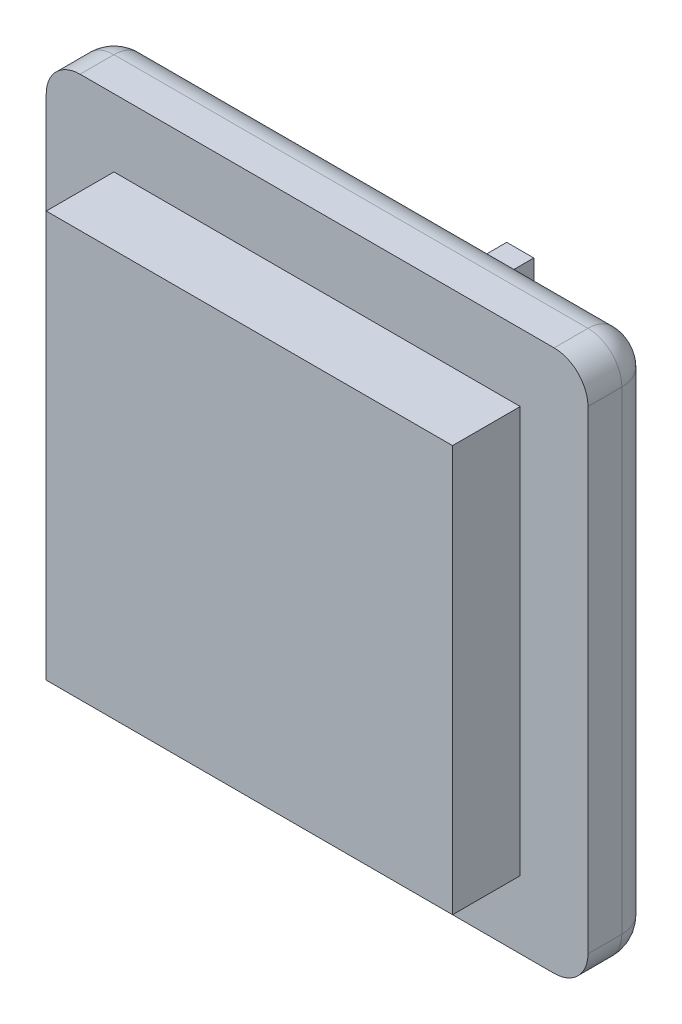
SolidWorks part; units mm, degrees
ref_plane "Plan de face" through (0, 0, 0) normal (0, 0, 1) x (1, 0, 0)
ref_plane "Plan de dessus" through (0, 0, 0) normal (0, 1, 0) x (1, 0, 0)
ref_plane "Plan de droite" through (0, 0, 0) normal (1, 0, 0) x (0, 0, -1)
sketch "Esquisse1" plane through (0, 0, 0) normal (0, 0, 1) x (1, 0, 0)
  line L1 (0, 0) -> (40, 0)
  line L2 (0, 0) -> (0, 40)
  line L3 (0, 40) -> (40, 40)
  line L4 (40, 0) -> (40, 40)
  dimension "D1" = 40
  dimension "D2" = 40
extrude "Boss.-Extru.1" add sketch "Esquisse1" along normal blind 5
sketch "Esquisse2" plane through (0, 0, 5) normal (0, 0, 1) x (1, 0, 0)
  line L0 (0, 40) -> (0, 0) construction
  line L1 (5, 35) -> (35, 35)
  line L2 (5, 35) -> (5, 5)
  line L3 (5, 5) -> (35, 5)
  line L4 (35, 35) -> (35, 5)
  line L5 (40, 40) -> (0, 40) construction
  dimension "D1" = 30
  dimension "D2" = 30
  dimension "D3" = 5
  dimension "D4" = 5
extrude "Boss.-Extru.2" add sketch "Esquisse2" along normal blind 5
fillet "Congé1" radius 2.5 4 edges at (0, 40, 2.5) (40, 40, 2.5) (0, 0, 2.5) (40, 0, 2.5)
fillet "Congé2" radius 2.5 8 edges at (0.7322, 39.2678, 0) (20, 40, 0) (39.2678, 39.2678, 0) (40, 20, 0) (39.2678, 0.7322, 0) (20, 0, 0) (0.7322, 0.7322, 0) (0, 20, 0)
sketch "Esquisse3" plane through (0, 0, 0) normal (0, 0, -1) x (-1, 0, 0)
  line L0 (-37.5, 40) -> (-2.5, 40) construction
  line L2 (0, 37.5) -> (0, 2.5) construction
  circle A0 centre (-20, 20) radius 10
  dimension "D1" = 20
  dimension "D3" = 20
  dimension "D6" = 20
extrude "Boss.-Extru.3" add sketch "Esquisse3" along normal blind 10
chamfer "Chanfrein1" distance 10 angle 10 1 edges at (10, 20, -10)
sketch "Esquisse4" plane through (0, 0, 0) normal (0, 0, -1) x (-1, 0, 0)
  line L0 (0, 37.5) -> (0, 2.5) construction
  line L1 (-20.25, 30.5) -> (-19.75, 30.5)
  line L2 (-20.25, 30.5) -> (-20.25, 32.5)
  line L3 (-20.25, 32.5) -> (-19.75, 32.5)
  line L4 (-19.75, 30.5) -> (-19.75, 32.5)
  line L5 (-37.5, 40) -> (-2.5, 40) construction
  dimension "D1" = 0.5
  dimension "D2" = 2
  dimension "D3" = 19.75
  dimension "D4" = 7.5
extrude "Enlèv. mat.-Extru.1" cut sketch "Esquisse4" against normal blind 0.2
pattern_circular "Répétition circulaire1" count 60 over 360 about axis through (20, 20, 0) along (0, 0, 1) of "Enlèv. mat.-Extru.1"
sketch "Esquisse5" plane through (0, 0, 0) normal (0, 0, -1) x (-1, 0, 0)
  line L1 (-20.25, 32.5) -> (-19.75, 32.5)
  line L2 (-20.25, 32.5) -> (-20.25, 33)
  line L3 (-20.25, 33) -> (-19.75, 33)
  line L4 (-19.75, 32.5) -> (-19.75, 33)
  dimension "D1" = 0.5
  dimension "D2" = 0.5
extrude "Enlèv. mat.-Extru.2" cut sketch "Esquisse5" against normal blind 0.2
pattern_circular "Répétition circulaire2" count 4 over 360 about axis through (20, 20, 0) along (0, 0, 1) of "Enlèv. mat.-Extru.2"
sketch "Esquisse6" plane through (0, 0, 0) normal (0, 0, -1) x (-1, 0, 0)
  line L0 (-37.5, 35) -> (-23.9839, 35) construction
  line L1 (-37.5, 37.5) -> (-37.5, 2.5) construction
  line L2 (-2.5, 2.5) -> (-2.5, 37.5) construction
  line L3 (-37.5, 40) -> (-2.5, 40) construction
  line L6 (-10.339, 35) -> (-2.5, 35) construction
  text T0 "DESCENTE" font "Century Gothic" height in points 5
  text T1 "MONTEE" font "Century Gothic" height in points 5
  dimension "D1" = 5
extrude "Enlèv. mat.-Extru.3" cut sketch "Esquisse6" against normal blind 0.2
ref_plane "Plan1" through (0, 20, 0) normal (0, 1, 0) x (1, 0, 0)
sketch "Esquisse7" plane through (0, 20, 0) normal (0, 1, 0) x (1, 0, 0)
  line L0 (28.2367, 10) -> (11.7633, 10) construction
  line L1 (19, 10) -> (21, 10)
  line L2 (19, 10) -> (19, 0)
  line L3 (19, 0) -> (21, 0)
  line L4 (21, 10) -> (21, 0)
  line L5 (40, -2.5) -> (40, -5) construction
  dimension "D1" = 10
  dimension "D2" = 2
  dimension "D3" = 19
extrude "Boss.-Extru.4" add sketch "Esquisse7" along normal blind 10
